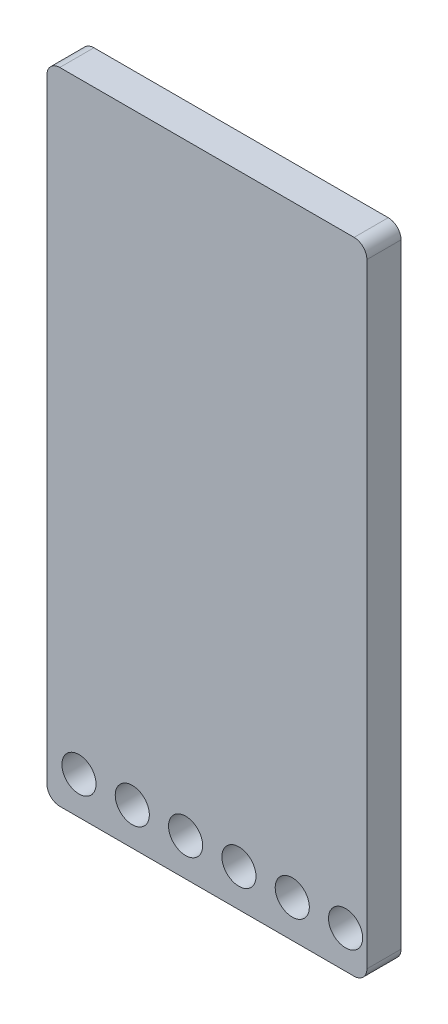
SolidWorks part; units mm, degrees
ref_plane "Ön Düzlem" through (0, 0, 0) normal (0, 0, 1) x (1, 0, 0)
ref_plane "Üst Düzlem" through (0, 0, 0) normal (0, 1, 0) x (1, 0, 0)
ref_plane "Sağ Düzlem" through (0, 0, 0) normal (1, 0, 0) x (0, 0, -1)
sketch "Çizim1" plane through (0, 0, 0) normal (0, 0, 1) x (1, 0, 0)
  line L1 (-6.9, -15) -> (6.9, -15)
  line L2 (-7.5, -14.4) -> (-7.5, 14.4)
  line L3 (-6.9, 15) -> (6.9, 15)
  line L4 (7.5, -14.4) -> (7.5, 14.4)
  line L5 (-7.5, -15) -> (7.5, 15) construction
  line L6 (-7.5, 15) -> (7.5, -15) construction
  arc A0 (6.9, -15) -> (7.5, -14.4) centre (6.9, -14.4) ccw
  arc A1 (-6.9, -15) -> (-7.5, -14.4) centre (-6.9, -14.4) cw
  arc A2 (-7.5, 14.4) -> (-6.9, 15) centre (-6.9, 14.4) cw
  arc A3 (6.9, 15) -> (7.5, 14.4) centre (6.9, 14.4) cw
  point P0 (0, 0)
  dimension "D3" = 0.6
  dimension "D1" = 30
  dimension "D2" = 15
extrude "Yükseklik-Ekstrüzyon1" add sketch "Çizim1" along normal blind 1.6
sketch "Çizim3" plane through (0, 0, 0) normal (0, 0, -1) x (-1, 0, 0)
  line L0 (-7.5, -14.4) -> (-7.5, 14.4) construction
  circle A0 centre (-6.5, -13.2473) radius 0.8
  circle A1 centre (-4, -13.2473) radius 0.8
  circle A2 centre (-1.5, -13.2473) radius 0.8
  circle A3 centre (1, -13.2473) radius 0.8
  circle A4 centre (3.5, -13.2473) radius 0.8
  circle A5 centre (6, -13.2473) radius 0.8
  dimension "D1" = 1.6
  dimension "D2" = 1
  dimension "D3" = 6
extrude "Kes-Ekstrüzyon1" cut sketch "Çizim3" against normal blind 1.6
